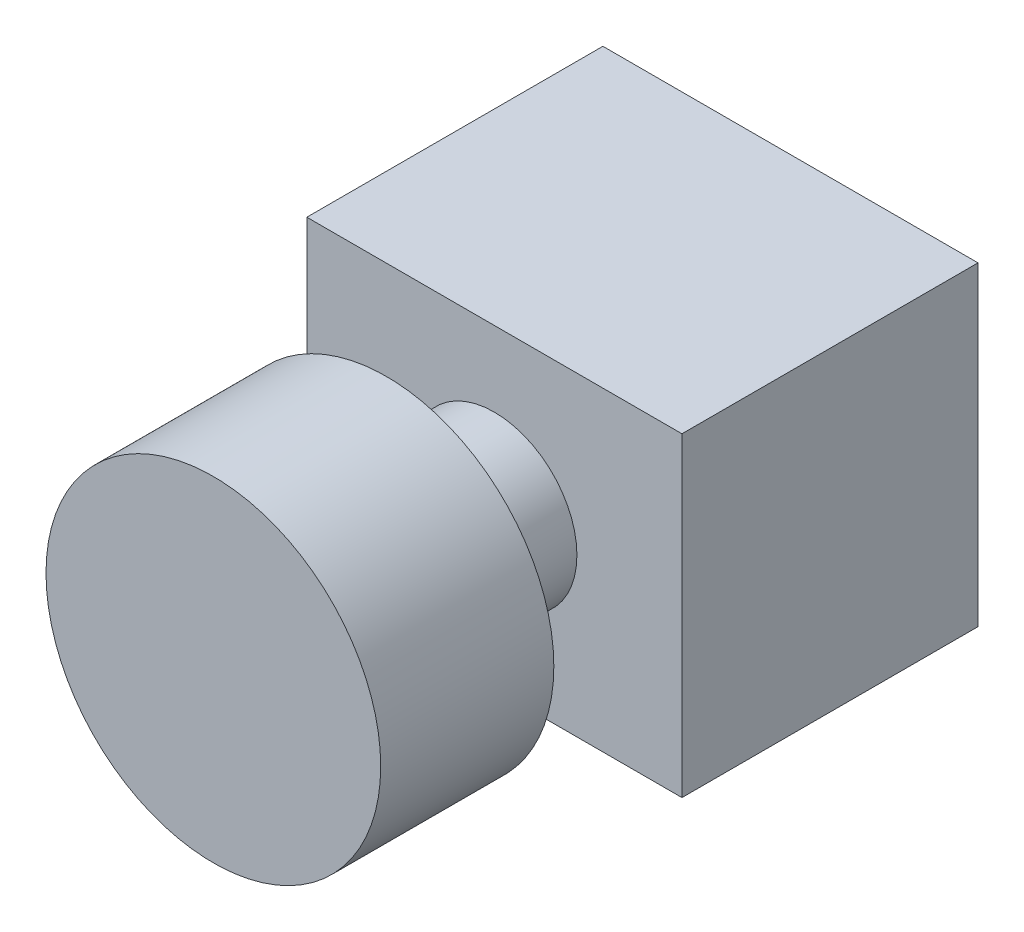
SolidWorks part; units mm, degrees
ref_plane "Front Plane" through (0, 0, 0) normal (0, 0, 1) x (1, 0, 0)
ref_plane "Top Plane" through (0, 0, 0) normal (0, 1, 0) x (1, 0, 0)
ref_plane "Right Plane" through (0, 0, 0) normal (1, 0, 0) x (0, 0, -1)
sketch "Sketch1" plane through (0, 0, 0) normal (0, 0, 1) x (1, 0, 0)
  line L1 (-8.255, -6.9342) -> (8.255, -6.9342)
  line L2 (-8.255, -6.9342) -> (-8.255, 6.9342)
  line L3 (-8.255, 6.9342) -> (8.255, 6.9342)
  line L4 (8.255, -6.9342) -> (8.255, 6.9342)
  line L5 (-8.255, -6.9342) -> (8.255, 6.9342) construction
  line L6 (-8.255, 6.9342) -> (8.255, -6.9342) construction
  point P0 (0, 0)
extrude "Boss-Extrude1" add sketch "Sketch1" along normal blind 13.0302
sketch "Sketch2" plane through (0, 0, 13.0302) normal (0, 0, 1) x (1, 0, 0)
  circle A0 centre (0, 0) radius 3.6322
extrude "Boss-Extrude2" add sketch "Sketch2" along normal blind 12.3698
sketch "Sketch3" plane through (0, 0, 25.4) normal (0, 0, 1) x (1, 0, 0)
  circle A0 centre (0, 0) radius 7.366
extrude "Boss-Extrude3" add sketch "Sketch3" against normal blind 7.62
